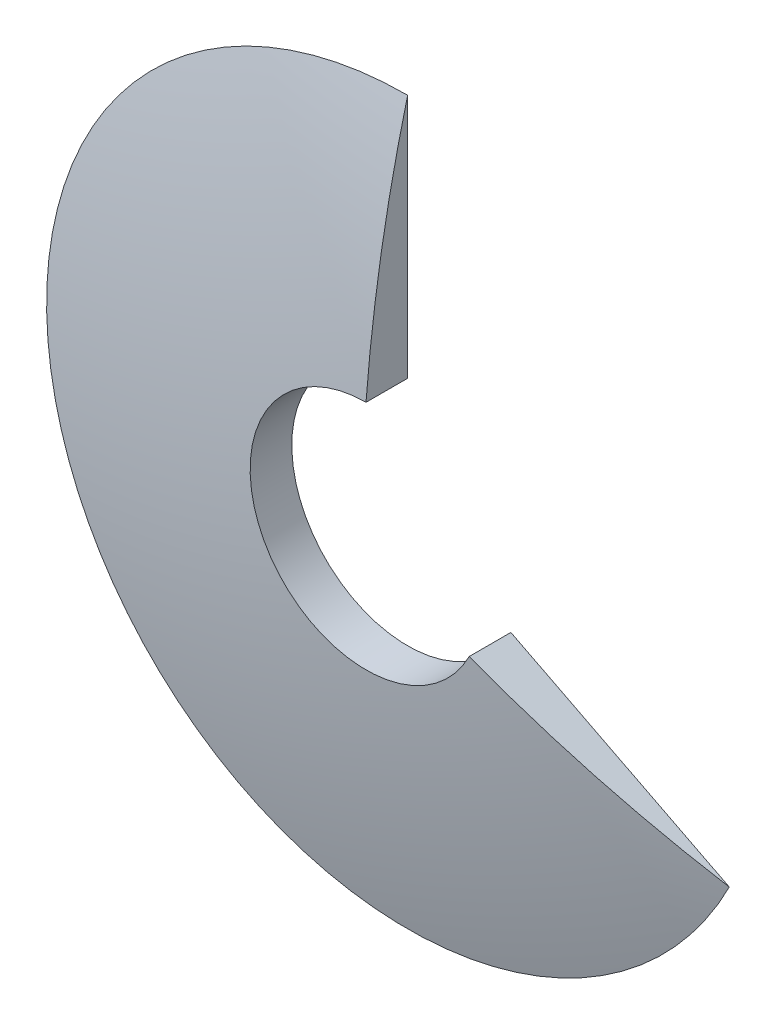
SolidWorks part; units mm, degrees
ref_plane "Přední rovina" through (0, 0, 0) normal (0, 0, 1) x (1, 0, 0)
ref_plane "Horní rovina" through (0, 0, 0) normal (0, 1, 0) x (1, 0, 0)
ref_plane "Pravá rovina" through (0, 0, 0) normal (1, 0, 0) x (0, 0, -1)
sketch "Skica1" plane through (0, 0, 0) normal (0, 0, 1) x (1, 0, 0)
  circle A0 centre (0, 0) radius 25
  circle A1 centre (0, 0) radius 77.9
extrude "Přidat vysunutím1" add sketch "Skica1" along normal blind 10
sketch "Skica2" plane through (0, 0, 0) normal (1, 0, 0) x (0, 0, -1)
  line L1 (-10, 77.9) -> (-10, -77.9) construction
  line L2 (-10, 0) -> (-24.2027, 0)
  line L3 (0, 77.9) -> (-24.2027, 77.9)
  line L4 (-24.2027, 77.9) -> (-24.2027, 0)
  arc A0 (-10, 0) -> (0, 77.9) centre (298.4205, 0) cw
revolve "Odebrat rotací2" cut sketch "Skica2" angle 360 about L2
scale "Měřítko1" scale about origin uniform scaling yes scale factor 0.655
sketch "Skica3" plane through (0, 0, 0) normal (0, 0, 1) x (1, 0, 0)
  line L0 (0, 0) -> (0, 60.6617)
  line L1 (0, 0) -> (54.05, -27.5398)
  circle A0 centre (0, 0) radius 60.6617
  dimension "D1" = 117
extrude "Odebrat vysunutím1" cut sketch "Skica3" along normal through all contours L1 A0 L0
